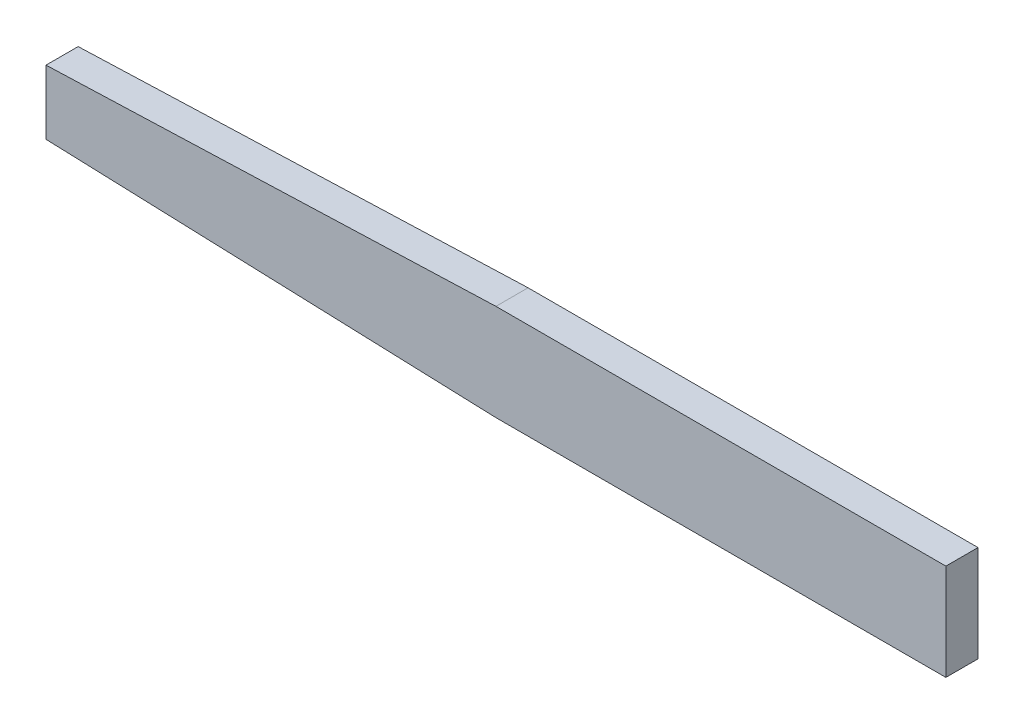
SolidWorks part; units mm, degrees
ref_plane "Front Plane" through (0, 0, 0) normal (0, 0, 1) x (1, 0, 0)
ref_plane "Top Plane" through (0, 0, 0) normal (0, 1, 0) x (1, 0, 0)
ref_plane "Right Plane" through (0, 0, 0) normal (1, 0, 0) x (0, 0, -1)
sketch "Sketch1" plane through (0, 0, 0) normal (0, 1, 0) x (1, 0, 0)
  line L0 (0, 0) -> (-304.8, 0)
  line L1 (0, 0) -> (0, 12.7)
  line L2 (-304.8, 0) -> (-304.8, 12.7)
  line L3 (-304.8, 12.7) -> (0, 12.7)
  line L4 (-304.8, 0) -> (-355.6, 0)
  line L5 (-355.6, 0) -> (-355.6, 12.7)
  line L6 (-355.6, 12.7) -> (-304.8, 12.7)
  dimension "D1" = 12.7
  dimension "D2" = 12.7
extrude "Boss-Extrude1" add sketch "Sketch1" along normal blind 38.1 contours L6 L5 L4 L2 | L3 L2 L0 L1
sketch "Sketch2" plane through (0, 0, 0) normal (0, 0, 1) x (1, 0, 0)
  line L0 (-355.6, 31.75) -> (-355.6, 6.35)
  line L1 (-355.6, 38.1) -> (-355.6, 0) construction
  line L2 (0, 0) -> (-177.8, 0)
  line L3 (0, 0) -> (-355.6, 0) construction
  line L4 (-177.8, 0) -> (-355.6, 6.35)
  line L5 (-355.6, 19.05) -> (0, 19.05)
  line L6 (0, 38.1) -> (0, 0) construction
  line L7 (-177.8, 38.1) -> (-355.6, 31.75)
extrude "Cut-Extrude1" cut sketch "Sketch2" against normal through all and the other way through all flip side to cut contours L7 L0 L4 L2
